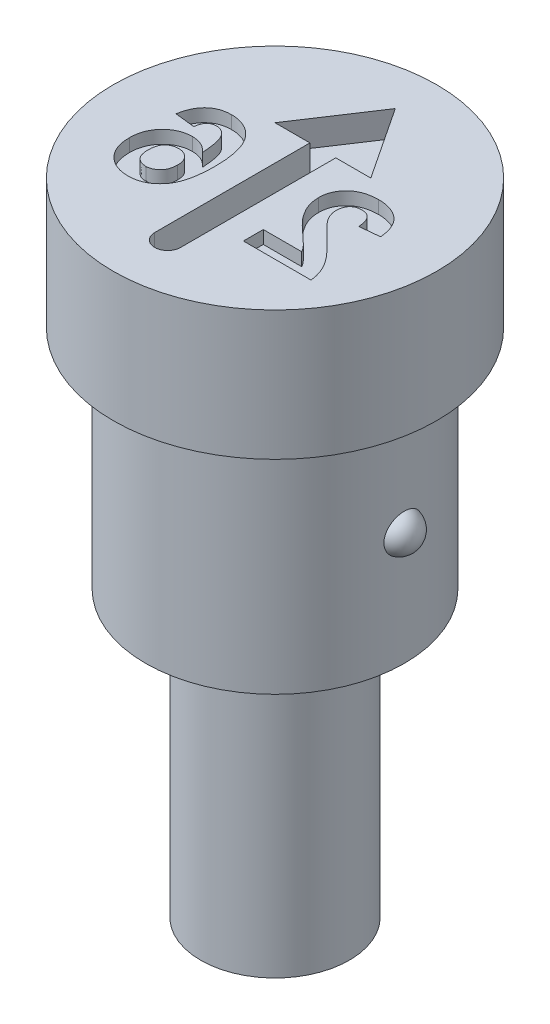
SolidWorks part; units mm, degrees
ref_plane "Front Plane" through (0, 0, 0) normal (0, 0, 1) x (1, 0, 0)
ref_plane "Top Plane" through (0, 0, 0) normal (0, 1, 0) x (1, 0, 0)
ref_plane "Right Plane" through (0, 0, 0) normal (1, 0, 0) x (0, 0, -1)
sketch "Sketch1" plane through (0, 0, 0) normal (0, 0, 1) x (1, 0, 0)
  line L0 (0, 0) -> (0, -9.9) construction
  line L1 (0, -2.75) -> (0, 2.75) construction
  line L2 (0, 0) -> (-2.5, 0)
  line L3 (-2.5, 0) -> (-2.5, -2)
  line L4 (-2.5, -2) -> (-2, -2)
  line L5 (-2, -2) -> (-2, -5.5)
  line L6 (-2, -5.5) -> (-1.15, -5.5)
  line L7 (-1.15, -5.5) -> (-1.15, -9.9)
  line L8 (-1.15, -9.9) -> (0, -9.9)
  line L9 (0, -9.9) -> (0, 0)
  dimension "D1" = 5
  dimension "D2" = 9.9
  dimension "D3" = 2
  dimension "D4" = 5.5
  dimension "D5" = 4
  dimension "D6" = 2.3
revolve "Revolve1" add sketch "Sketch1" angle 360 about L0
sketch "Sketch3" plane through (0, 0, 0) normal (0, 1, 0) x (1, 0, 0)
  line L0 (0, 1.86) -> (-0.7413, 0.74)
  line L1 (-0.7413, 0.74) -> (-0.2, 0.74)
  line L2 (-0.2, 0.74) -> (-0.2, -1.66)
  line L3 (0.2, -1.66) -> (0.2, 0.74)
  line L4 (0.2, 0.74) -> (0.7413, 0.74)
  line L5 (0.7413, 0.74) -> (0, 1.86)
  line L6 (0, 1.86) -> (0, -1.86) construction
  arc A0 (-0.2, -1.66) -> (0.2, -1.66) centre (0, -1.66) ccw
  dimension "D3" = 0.2
  dimension "D1" = 1.12
  dimension "D2" = 67
  dimension "D4" = 3.52
extrude "Cut-Extrude1" cut sketch "Sketch3" against normal blind 0.4
sketch "Sketch4" plane through (0, 0, 0) normal (0, 1, 0) x (1, 0, 0)
  text T0 "26" font "Arial" height 1.6
extrude "Cut-Extrude2" cut sketch "Sketch4" against normal blind 0.2
sketch "Sketch5" plane through (0, 0, 0) normal (0, 0, 1) x (1, 0, 0)
  line L2 (1.9174, -3.45) -> (1.9174, -4.05)
  line L3 (1.9174, -3.45) -> (1.9174, -4.05) construction
  line L4 (-2, -3.75) -> (1.9174, -3.75) construction
  line L5 (-2, -2) -> (-2, -5.5) construction
  arc A1 (1.9174, -4.05) -> (1.9174, -3.45) centre (1.9174, -3.75) ccw
  dimension "D1" = 0.3
revolve "Revolve2" add sketch "Sketch5" angle 360 about L2
